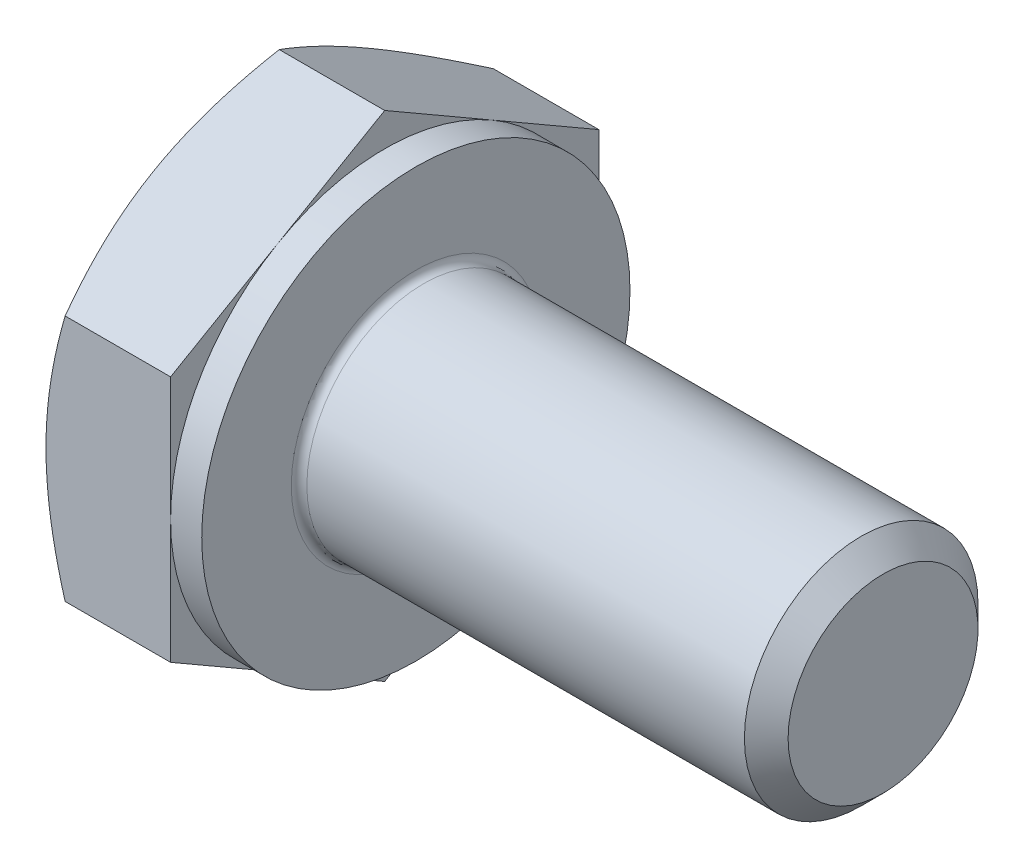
SolidWorks part; units mm, degrees
extrude "BaseHead" add sketch "Sketch1" along normal blind 2
sketch "Sketch1" plane through (0, 0, 0) normal (1, 0, 0) x (0, 0, -1)
  line L0 (2.75, 1.5877) -> (2.75, -1.5877)
  line L1 (-2.75, 1.5877) -> (-2.75, -1.5877)
  line L2 (2.75, -1.5877) -> (0, -3.1754)
  line L3 (0, -3.1754) -> (-2.75, -1.5877)
  line L4 (2.75, 1.5877) -> (0, 3.1754)
  line L5 (0, 3.1754) -> (-2.75, 1.5877)
revolve "HeadChamfer" cut sketch "Sketch3" angle 360 about L6
sketch "Sketch3" plane through (0, 0, 0) normal (0, 0, 1) x (1, 0, 0)
  line L0 (0, 2.75) -> (3.1324, 8.1754)
  line L1 (0, 3.1754) -> (0, 1.5877) construction
  line L2 (3.1324, 8.1754) -> (3.1324, 13.1754)
  line L3 (3.1324, 13.1754) -> (-10, 13.1754)
  line L4 (-10, 13.1754) -> (-10, 2.75)
  line L5 (-10, 2.75) -> (0, 2.75)
  line L6 (0, 0) -> (99.06, 0) construction
  line L7 (2, 3.1754) -> (0, 3.1754) construction
ref_plane "Plane1" through (0, 0, 0) normal (0, 0, 1) x (1, 0, 0)
ref_plane "Plane2" through (0, 0, 0) normal (0, 1, 0) x (1, 0, 0)
ref_plane "Plane3" through (0, 0, 0) normal (1, 0, 0) x (0, 0, -1)
other "Configuration Table"
sketch "BodySke" plane through (0, 0, 0) normal (0, 0, 1) x (1, 0, 0)
  line L0 (0, 1.5877) -> (0, -1.5877) construction
  line L1 (0, 0) -> (8, 0)
  line L2 (0, 0) -> (0, 1.5)
  line L3 (0, 1.5) -> (7.7195, 1.5)
  line L4 (8, 0) -> (8, 1.2195)
  line L5 (2, 3.1754) -> (2, 1.5877) construction
  line L6 (8, 1.2195) -> (7.7195, 1.5)
  line L7 (0, 0) -> (96.52, 0) construction
  line L8 (8, -1.2195) -> (7.7195, -1.5) construction
  line L9 (0, -1.5) -> (7.7195, -1.5) construction
  line L10 (2.5, 15.24) -> (2.5, -1.27) construction
  line L12 (2, 1.5877) -> (2, -1.5877) construction
revolve "BaseBody" add sketch "BodySke"
fillet "HeadFillet" radius 0.1 1 edges at (2, 0, -1.5)
sketch "Sketch4" plane through (0, 0, 0) normal (0, 0, 1) x (1, 0, 0)
  line L1 (2, 3.1754) -> (2, 1.5877) construction
  line L2 (2, 2.75) -> (1.6, 2.75)
  line L3 (2, 2.75) -> (2, 13.1754)
  line L4 (2, 13.1754) -> (1.6, 13.1754)
  line L5 (0, 0) -> (95.25, 0) construction
  line L6 (0, 0) -> (96.52, 0) construction
  line L7 (1.6, 2.75) -> (1.6, 13.1754)
  line L8 (2, 3.1754) -> (0.2456, 3.1754) construction
revolve "BearingFace" cut sketch "Sketch4" angle 360 about L5
sketch "ThdSchSke" plane through (0, 0, 0) normal (0, 0, 1) x (1, 0, 0)
  line L0 (2.5, -1.2195) -> (2.3036, -1.5)
  line L1 (2.5, -1.2195) -> (2.6964, -1.5)
  line L2 (2.6964, -1.5) -> (2.6964, -1.875)
  line L3 (-3.175, 0) -> (5.1513, 0) construction
  line L5 (2.6964, -1.875) -> (2.3036, -1.875)
  line L6 (2.3036, -1.875) -> (2.3036, -1.5)
revolve "ThreadSchematic" [suppressed] cut sketch "ThdSchSke" angle 360 about L3
pattern_linear "ThdSchPat" [suppressed]
equation "\"D3@Sketch1\" = \"Width_flats@Sketch1\" / 2"
equation "\"D4@Sketch1\" = \"D3@Sketch1\""
equation "\"D5@Sketch1\" = \"D4@Sketch1\""
equation "\"Thread_minor@ThreadCosmetic\" = \"Minor_dia@BodySke\""
equation "\"D1@Sketch3\" = \"Width_flats@Sketch1\" / 2"
equation "\"D1@Sketch4\" = \"Width_flats@Sketch1\""
equation "\"Thread_length@ThreadCosmetic\" = \"Length@BodySke\" - \"Advance@BodySke\""
equation "\"Thread_minor@ThdSchSke\" = \"Minor_dia@BodySke\""
equation "\"Diameter@ThdSchSke\" = \"Diameter@BodySke\""
equation "\"Overcut@ThdSchSke\" = \"Diameter@BodySke\" * 1.25"
equation "\"Start@ThdSchSke\" = \"Head_ht@BaseHead\" + \"Length@BodySke\" - \"Thread_length@ThreadCosmetic\"  '---Non-countersunk---"
equation "\"Num_threads@ThdSchPat\" = int( \"Thread_length@ThreadCosmetic\" / \"Advance@BodySke\" + 0.999 )  + 1"
equation "\"Advance@ThdSchPat\" = \"Thread_length@ThreadCosmetic\" /  (\"Num_threads@ThdSchPat\" - 1) 'relax it"
equation "\"Num_threads@ThdSchPat\" = \"Num_threads@ThdSchPat\" - sgn( \"Num_threads@ThdSchPat\" - 1) '---chamfered tips only---"
